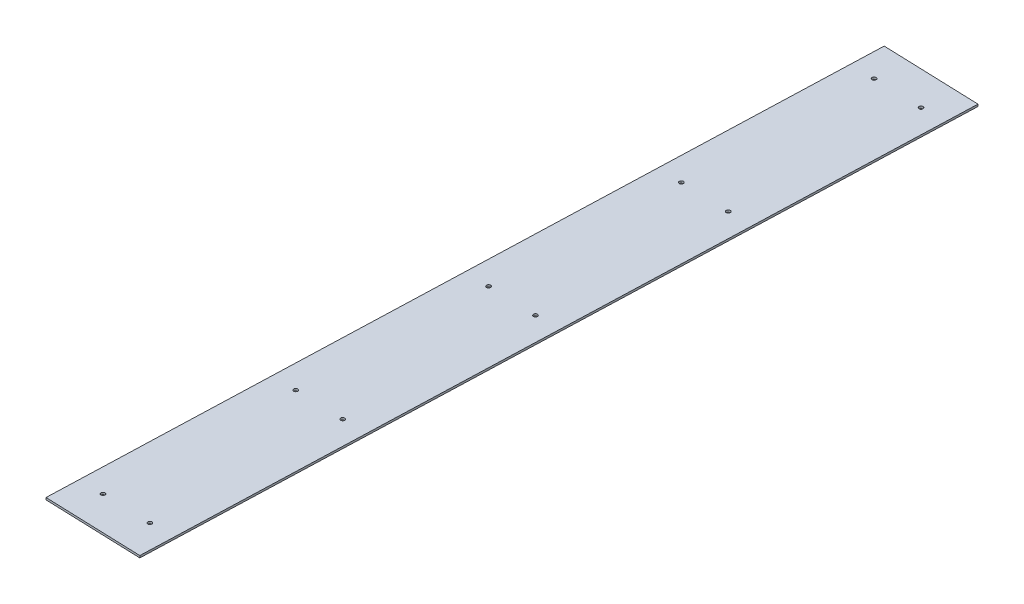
SolidWorks part; units mm, degrees
ref_plane "Front Plane" through (0, 0, 0) normal (0, 0, 1) x (1, 0, 0)
ref_plane "Top Plane" through (0, 0, 0) normal (0, 1, 0) x (1, 0, 0)
ref_plane "Right Plane" through (0, 0, 0) normal (1, 0, 0) x (0, 0, -1)
ref_plane "Plane1" through (791.6465, -124.1443, -759.1165) normal (0.9994, 0, 0.0347) x (0.0347, 0, -0.9994)
sketch "Sketch1" plane through (0, -1.6256, 0) normal (0, -1, 0) x (1, 0, 0)
  line L0 (795.2003, -861.3549) -> (833.2773, -860.0314) construction
  line L1 (781.2861, -461.0617) -> (809.1145, -1261.6481) construction
  line L2 (795.2003, -861.3549) -> (757.1233, -862.6785) construction
  line L3 (746.0937, -545.3701) -> (768.1529, -1179.9869)
  line L4 (822.2477, -542.723) -> (844.3069, -1177.3398)
  line L5 (768.1529, -1179.9869) -> (844.3069, -1177.3398)
  line L6 (822.2477, -542.723) -> (746.0937, -545.3701)
  line L7 (781.2861, -461.0617) -> (809.0579, -1260.0203) construction
  point P4 (0, 0)
  point P8 (757.1233, -862.6785)
  point P11 (833.2773, -860.0314)
  dimension "D1" = 38.1
  dimension "D2" = 635
extrude "Boss-Extrude1" add sketch "Sketch1" along normal blind 1.6256
sketch "Sketch2" plane through (0, -3.2512, 0) normal (0, -1, 0) x (1, 0, 0)
  line L0 (784.1707, -544.0466) -> (806.2299, -1178.6633) construction
  line L1 (822.2477, -542.723) -> (746.0937, -545.3701) construction
  line L2 (768.1529, -1179.9869) -> (844.3069, -1177.3398) construction
  line L3 (784.1707, -544.0466) -> (765.1322, -544.7084) construction
  line L4 (765.1322, -544.7084) -> (766.0146, -570.093) construction
  line L6 (766.0146, -570.093) -> (771.0882, -716.0549) construction
  circle A0 centre (766.0146, -570.093) radius 1.5875
  circle A1 centre (771.0882, -716.0549) radius 1.5875
  circle A2 centre (776.1618, -862.0167) radius 1.5875
  circle A3 centre (781.2354, -1007.9786) radius 1.5875
  circle A4 centre (786.309, -1153.9404) radius 1.5875
  circle A5 centre (824.386, -1152.6169) radius 1.5875
  circle A6 centre (819.3124, -1006.655) radius 1.5875
  circle A7 centre (814.2388, -860.6932) radius 1.5875
  circle A8 centre (809.1652, -714.7313) radius 1.5875
  circle A9 centre (804.0916, -568.7695) radius 1.5875
  dimension "D3" = 3.175
  dimension "D4" = 5
  dimension "D1" = 19.05
  dimension "D2" = 25.4
  dimension "D5" = 146.05
extrude "Cut-Extrude1" cut sketch "Sketch2" against normal up to surface (1.6256 mm away)
